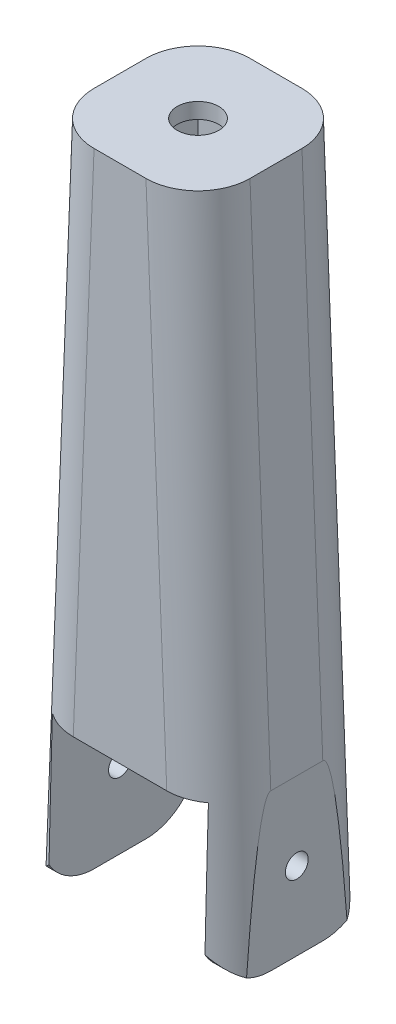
SolidWorks part; units mm, degrees
ref_plane "Front Plane" through (0, 0, 0) normal (0, 0, 1) x (1, 0, 0)
ref_plane "Top Plane" through (0, 0, 0) normal (0, 1, 0) x (1, 0, 0)
ref_plane "Right Plane" through (0, 0, 0) normal (1, 0, 0) x (0, 0, -1)
sketch "Sketch1" plane through (0, 0, 0) normal (0, 1, 0) x (1, 0, 0)
  line L1 (-15, -15) -> (15, -15)
  line L2 (-15, -15) -> (-15, 15)
  line L3 (-15, 15) -> (15, 15)
  line L4 (15, -15) -> (15, 15)
  line L5 (-15, -15) -> (15, 15) construction
  line L6 (-15, 15) -> (15, -15) construction
  point P0 (0, 0)
  dimension "D1" = 30
  dimension "D2" = 30
extrude "Boss-Extrude1" add sketch "Sketch1" along normal blind 100
sketch "Sketch2" plane through (15, 0, 0) normal (1, 0, 0) x (0, 0, -1)
  line L1 (-15, 0) -> (15, 0)
  line L2 (-15, 0) -> (-15, -30)
  line L3 (-15, -30) -> (15, -30)
  line L4 (15, 0) -> (15, -30)
  dimension "D1" = 30
  dimension "D2" = 30
extrude "Boss-Extrude2" add sketch "Sketch2" along normal blind 4 separate body
sketch "Sketch3" plane through (0, 0, -15) normal (0, 0, -1) x (-1, 0, 0)
  line L0 (-19, 0) -> (-15, 100)
  line L1 (-15, 100) -> (-15, 0)
  line L2 (-15, 0) -> (-19, 0)
  point P6 (-18, 0)
extrude "Boss-Extrude3" add sketch "Sketch3" against normal blind 30
sketch "Sketch4" plane through (-15, 0, 0) normal (-1, 0, 0) x (0, 0, 1)
  line L0 (15, -30) -> (-15, -30) construction
  line L1 (-15, 0) -> (15, 0)
  line L2 (-15, 0) -> (-15, -30)
  line L3 (-15, -30) -> (15, -30)
  line L4 (15, 0) -> (15, -30)
extrude "Boss-Extrude4" add sketch "Sketch4" along normal blind 4 separate body
sketch "Sketch5" plane through (0, 0, -15) normal (0, 0, -1) x (-1, 0, 0)
  line L0 (19, 0) -> (15, 100)
  line L1 (15, 100) -> (15, 0)
  line L2 (15, 0) -> (19, 0)
extrude "Boss-Extrude5" add sketch "Sketch5" against normal blind 30
fillet "Fillet1" radius 10 4 edges at (-17, -30, 15) (17, -30, 15) (-17, -30, -15) (17, -30, -15)
sketch "Sketch6" plane through (19, 0, 0) normal (1, 0, 0) x (0, 0, -1)
  line L0 (-15, 0) -> (15, 0) construction
  circle A0 centre (0, -15) radius 2.2
  dimension "D2" = 4.4
  dimension "D1" = 15
extrude "Cut-Extrude1" cut sketch "Sketch6" against normal through all
sketch "Sketch7" plane through (0, 0, 0) normal (0, -1, 0) x (-1, 0, 0)
  line L0 (15, -15) -> (-15, -15) construction
  line L1 (-10, -10) -> (10, -10)
  line L2 (-10, -10) -> (-10, 10)
  line L3 (-10, 10) -> (10, 10)
  line L4 (10, -10) -> (10, 10)
  line L5 (-15, 15) -> (15, 15) construction
  line L6 (-15, 15) -> (-15, -15) construction
  line L7 (15, -15) -> (15, 15) construction
  dimension "D1" = 5
  dimension "D2" = 5
  dimension "D3" = 5
  dimension "D4" = 5
extrude "Cut-Extrude2" cut sketch "Sketch7" against normal blind 97
sketch "Sketch8" plane through (0, 100, 0) normal (0, 1, 0) x (1, 0, 0)
  circle A0 centre (0, 0) radius 4
  dimension "D1" = 8
extrude "Cut-Extrude3" cut sketch "Sketch8" against normal through all
fillet "Fillet2" radius 10 4 edges at (17, 50, -15) (17, 50, 15) (-17, 50, -15) (-17, 50, 15)
